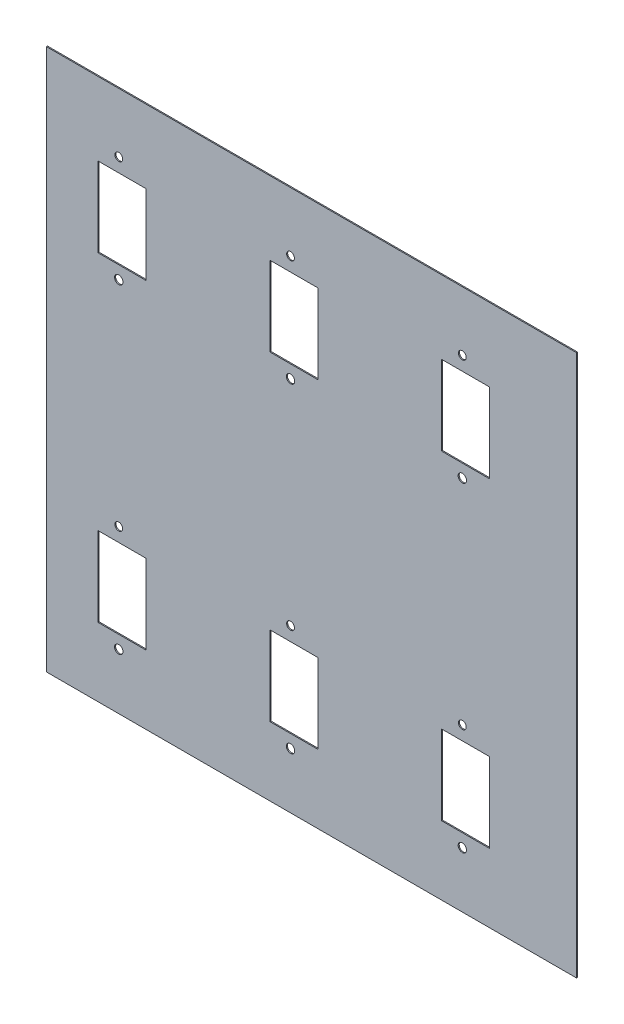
SolidWorks part; units mm, degrees
ref_plane "Front Plane" through (0, 0, 0) normal (0, 0, 1) x (1, 0, 0)
ref_plane "Top Plane" through (0, 0, 0) normal (0, 1, 0) x (1, 0, 0)
ref_plane "Right Plane" through (0, 0, 0) normal (1, 0, 0) x (0, 0, -1)
sketch "Sketch1" plane through (0, 0, 0) normal (0, 0, 1) x (1, 0, 0)
  line L1 (-292.9346, 286.4008) -> (969.0348, 286.4008)
  line L2 (-292.9346, 286.4008) -> (-292.9346, -1002.7914)
  line L3 (-292.9346, -1002.7914) -> (969.0348, -1002.7914)
  line L4 (969.0348, 286.4008) -> (969.0348, -1002.7914)
extrude "Extrude1" add sketch "Sketch1" along normal blind 2.54
sketch "Sketch2" plane through (0, 0, 2.54) normal (0, 0, 1) x (1, 0, 0)
  line L1 (-170.0737, 112.0966) -> (-55.6475, 112.0966)
  line L2 (-170.0737, 112.0966) -> (-170.0737, -77.1862)
  line L3 (-170.0737, -77.1862) -> (-55.6475, -77.1862)
  line L4 (-55.6475, 112.0966) -> (-55.6475, -77.1862)
extrude "Cut-Extrude1" cut sketch "Sketch2" against normal through all
sketch "Sketch3" plane through (0, 0, 2.54) normal (0, 0, 1) x (1, 0, 0)
  circle A0 centre (-120.6834, 145.099) radius 9.3347
  circle A1 centre (-120.6834, -108.0953) radius 9.9588
extrude "Cut-Extrude2" cut sketch "Sketch3" against normal through all
pattern_linear "LPattern1" count 2 spacing 762 along (0, -1, 0) count 3 spacing 408.94 along (1, 0, 0) of "Cut-Extrude1", "Cut-Extrude2"
